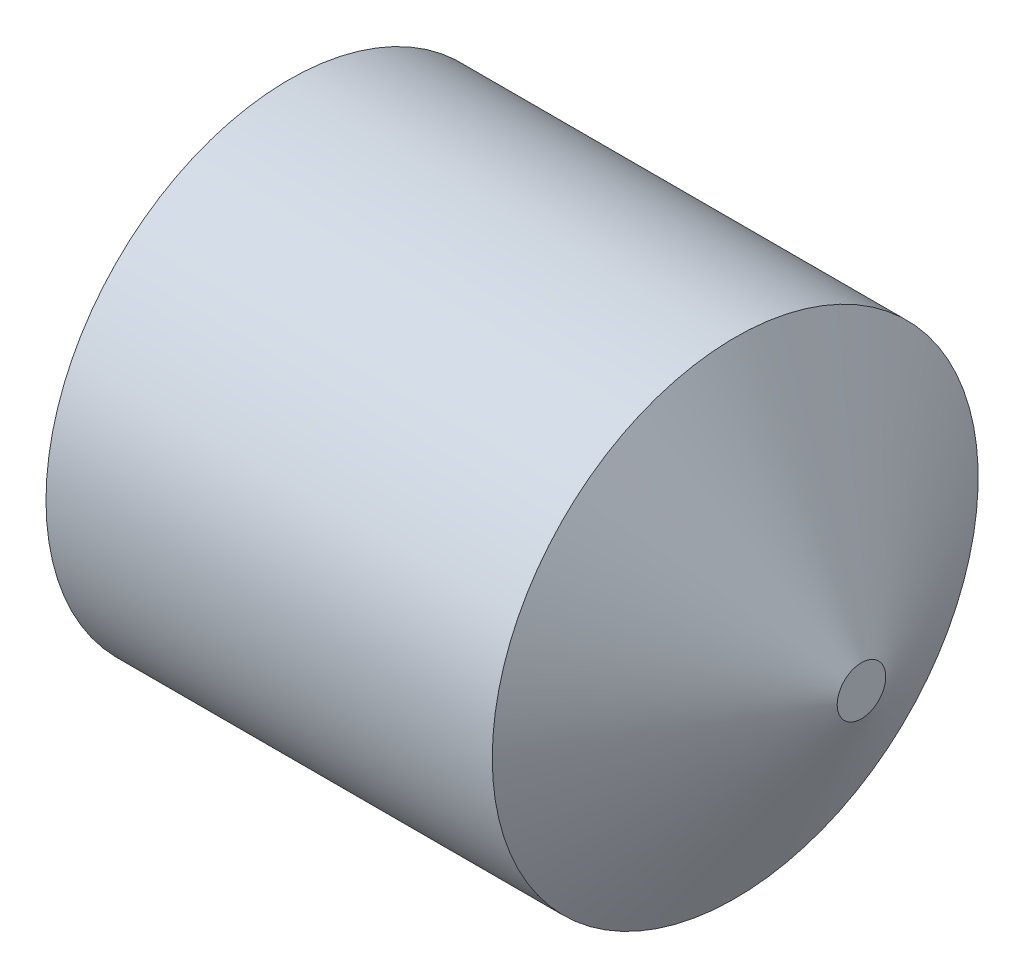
SolidWorks part; units mm, degrees
ref_plane "Front Plane" through (0, 0, 0) normal (0, 0, 1) x (1, 0, 0)
ref_plane "Top Plane" through (0, 0, 0) normal (0, 1, 0) x (1, 0, 0)
ref_plane "Right Plane" through (0, 0, 0) normal (1, 0, 0) x (0, 0, -1)
sketch "BodySke" plane through (0, 0, 0) normal (0, 0, 1) x (1, 0, 0)
  line L0 (0, 0) -> (3.28, 0) construction
  line L1 (2, 0) -> (2, 0.08)
  line L2 (2, 0.08) -> (1.5843, 0.8)
  line L3 (1.5843, 0.8) -> (0, 0.8)
  line L4 (0, 0.8) -> (0, 0)
  line L5 (0, 0) -> (2, 0)
  line L6 (1.65, 1.0236) -> (1.65, -0.6432) construction
  point P5 (0, 0.601)
  dimension "Diameter" = 1.6
  dimension "Length" = 2
  dimension "Chamfer_End" = 0.16
  dimension "Angle" = 60
  dimension "Minor_dia" = 1.202
  dimension "Advance" = 0.35
revolve "BaseBody" add sketch "BodySke" angle 360 about L0
sketch "HeadChamferSke" plane through (0, 0, 0) normal (0, 0, 1) x (1, 0, 0)
  line L0 (0, 0) -> (2.4505, 0) construction
  line L1 (0, 0.8) -> (0, 0.601)
  line L2 (0, 0.8) -> (0.1149, 0.8)
  line L3 (0.1149, 0.8) -> (0, 0.601)
  line L4 (1.5843, 0.8) -> (0, 0.8) construction
  line L5 (0, 0.8) -> (0, -0.8) construction
  line L6 (0, 0.8) -> (0, 0) construction
  dimension "Angle" = 30
revolve "HeadChamfer" cut sketch "HeadChamferSke" angle 360 about L0
sketch "HexagonSocketSke" plane through (0, 0, 0) normal (-1, 0, 0) x (0, 0, 1)
  line L1 (0, 0.4041) -> (-0.35, 0.2021)
  line L2 (-0.35, 0.2021) -> (-0.35, -0.2021)
  line L3 (-0.35, -0.2021) -> (0, -0.4041)
  line L4 (0, -0.4041) -> (0.35, -0.2021)
  line L5 (0.35, -0.2021) -> (0.35, 0.2021)
  line L6 (0.35, 0.2021) -> (0, 0.4041)
  circle A0 centre (0, 0) radius 0.35 construction
  dimension "Hexagon_Width" = 0.7
extrude "HexagonSocket" cut sketch "HexagonSocketSke" against normal blind 0.7
sketch "ThdSchSke" plane through (0, 0, 0) normal (0, 0, 1) x (1, 0, 0)
  line L0 (0, 0) -> (2.6881, 0) construction
  line L1 (0.2351, 1.0298) -> (0.2351, 0.8)
  line L2 (0.2351, 1.0298) -> (0.4649, 1.0298)
  line L3 (0.4649, 1.0298) -> (0.4649, 0.8)
  line L4 (0.4649, 0.8) -> (0.35, 0.601)
  line L5 (0.35, 0.601) -> (0.2351, 0.8)
  line L6 (1.5843, 0.8) -> (0.1149, 0.8) construction
  dimension "D1" = 0.35
revolve "ThreadSchematic" [suppressed] cut sketch "ThdSchSke" angle 360 about L0
pattern_linear "ThdSchPat" [suppressed] count 4 along (1, 0, 0)
equation "\"Minor_dia@ThreadCosmetic\" = \"Minor_dia@BodySke\""
equation "\"D1@ThdSchSke\" = \"Advance@BodySke\""
equation "\"Advance@ThdSchPat\" = \"Advance@BodySke\""
equation "\"D1@ThdSchPat\" =  int(  ( \"Length@BodySke\" -  ( \"Diameter@BodySke\" / 2 - \"Chamfer_End@BodySke\" / 2 ) * 0.55  )  / \"Advance@BodySke\"  )  "
